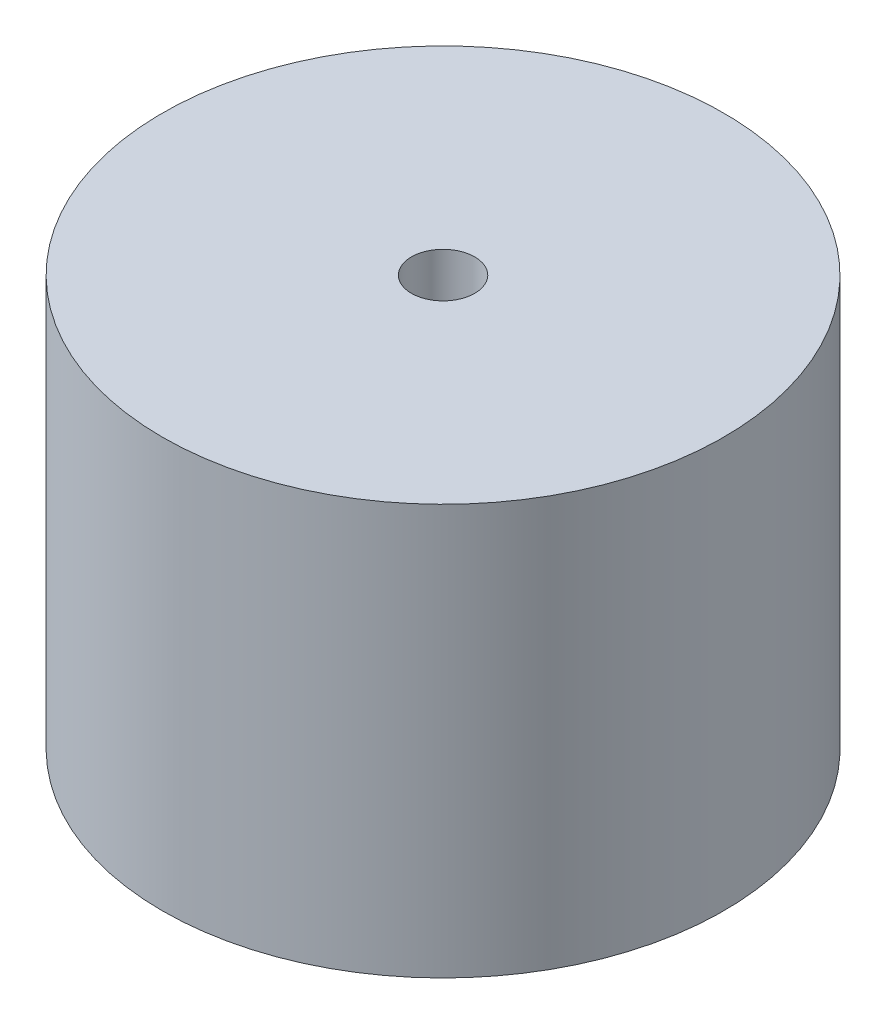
SolidWorks part; units mm, degrees
ref_plane "Front Plane" through (0, 0, 0) normal (0, 0, 1) x (1, 0, 0)
ref_plane "Top Plane" through (0, 0, 0) normal (0, 1, 0) x (1, 0, 0)
ref_plane "Right Plane" through (0, 0, 0) normal (1, 0, 0) x (0, 0, -1)
sketch "Sketch1" plane through (0, 0, 0) normal (0, 1, 0) x (1, 0, 0)
  circle A0 centre (0, 0) radius 26
  circle A1 centre (0, 0) radius 2.9297
extrude "Boss-Extrude1" add sketch "Sketch1" along normal blind 38
